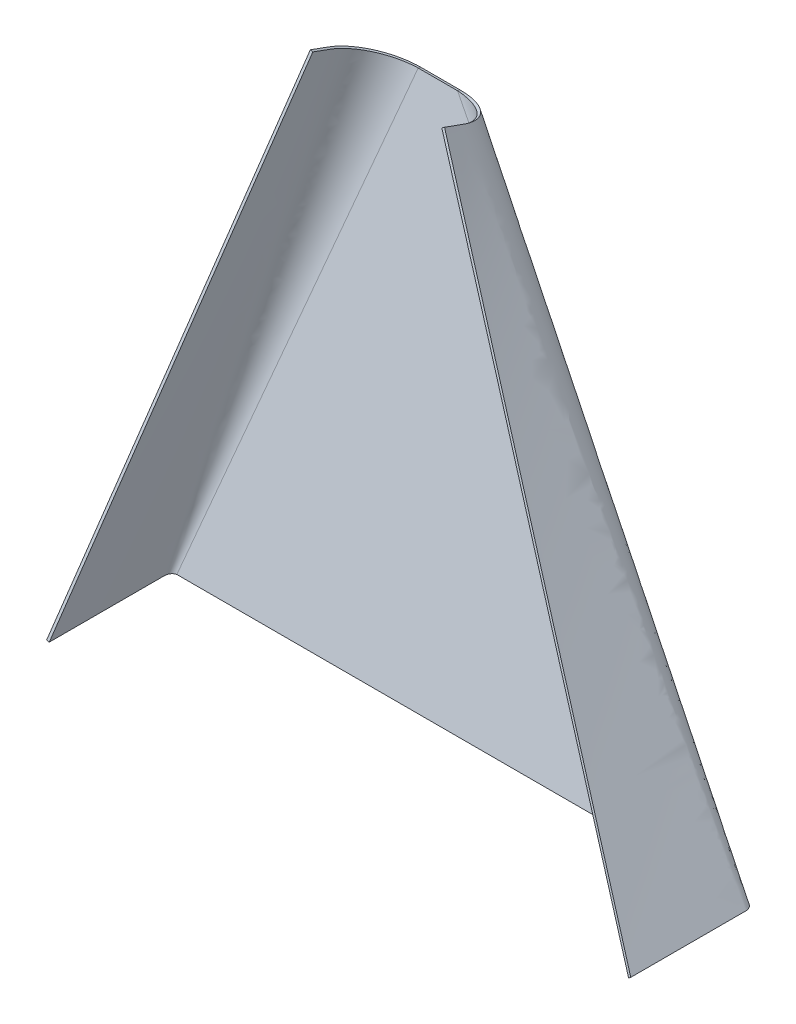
SolidWorks part; units mm, degrees
ref_plane "Ebene vorne" through (0, 0, 0) normal (0, 0, 1) x (1, 0, 0)
ref_plane "Ebene oben" through (0, 0, 0) normal (0, 1, 0) x (1, 0, 0)
ref_plane "Ebene rechts" through (0, 0, 0) normal (1, 0, 0) x (0, 0, -1)
ref_plane "Ebene1" through (0, 527, 0) normal (0, 1, 0) x (-1, 0, 0)
sketch "Skizze1" plane through (0, 527, 0) normal (0, 1, 0) x (-1, 0, 0)
  line L0 (148.5, -182.404) -> (148.5, -201.596) construction
  line L1 (159.5234, -192) -> (137.4766, -192) construction
  point P4 (148.5, -192)
  dimension "D1" = 148.5
  dimension "D2" = 192
ref_plane "Ebene2" through (0, 527.0603, -191.8343) normal (0, 0.9397, -0.342) x (-1, 0, 0)
sketch "Skizze3" plane through (0, 0, 0) normal (0, 1, 0) x (1, 0, 0)
  line L0 (-326.5, 0) -> (-326.5, 128.5)
  line L1 (-316.5, 138.5) -> (316.5, 138.5)
  line L2 (326.5, 128.5) -> (326.5, 0)
  arc A0 (-326.5, 128.5) -> (-316.5, 138.5) centre (-316.5, 128.5) cw
  arc A1 (316.5, 138.5) -> (326.5, 128.5) centre (316.5, 128.5) cw
  dimension "D1" = 10
  dimension "D2" = 138.5
  dimension "D3" = 138.5
  dimension "D4" = 653
  dimension "D5" = 326.5
sketch "Skizze4" plane through (0, 527.0603, -191.8343) normal (0, 0.9397, -0.342) x (-1, 0, 0)
  line L0 (223.5, 0) -> (223.5, -22)
  line L1 (170.5, -75) -> (126.5, -75)
  line L2 (73.5, -22) -> (73.5, 0)
  arc A0 (223.5, -22) -> (170.5, -75) centre (170.5, -22) cw
  arc A1 (126.5, -75) -> (73.5, -22) centre (126.5, -22) cw
  dimension "D1" = 53
  dimension "D2" = 150
  dimension "D3" = 75
  dimension "D4" = 73.5
  dimension "D5" = 75
sheet metal parameters "Blech7" thickness 3 parameters "D1"=4.5, "Dicke"=3
lofted bend "Ausgeformte Biegungen9" parameters "D1"=0, "D12"=3
other "Freiform-Biegung11" parameters "D1"=1000, "D4"=57.296, "D5"=1
other "Freiform-Biegung12" parameters "D1"=1000, "D4"=57.296, "D5"=2
flat pattern "Abwicklung1"
sketch "Biegung-Linien1" plane through (0, 0, 0) normal (0, 1, 0) x (-1, 0, 0)
other "Abwickeln-<Freiform-Biegung11>1"
other "Abwickeln-<Freiform-Biegung12>1"
